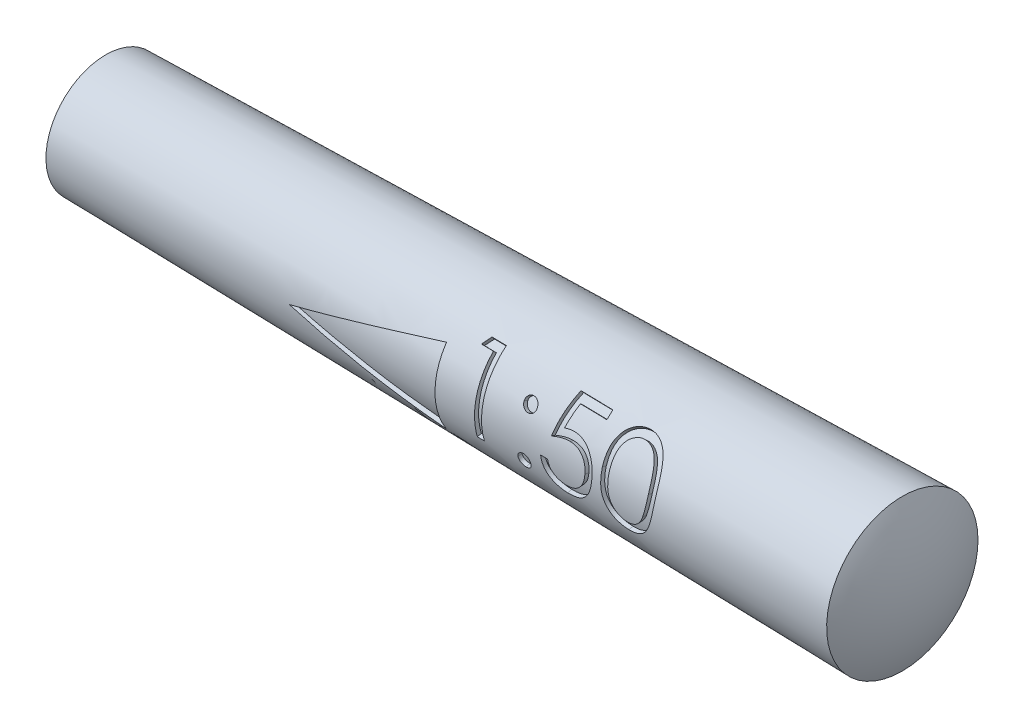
SolidWorks part; units mm, degrees
ref_plane "Front Plane" through (0, 0, 0) normal (0, 0, 1) x (1, 0, 0)
ref_plane "Top Plane" through (0, 0, 0) normal (0, 1, 0) x (1, 0, 0)
ref_plane "Right Plane" through (0, 0, 0) normal (1, 0, 0) x (0, 0, -1)
sketch "Sketch1" plane through (0, 0, 0) normal (1, 0, 0) x (0, 0, -1)
  circle A0 centre (0, 0) radius 0.75
  dimension "D1" = 1.5
extrude "Extrude1" add sketch "Sketch1" along normal mid plane 10
draft "Draft1" type of draft neutral plane draft angle 1.146 faces to draft 1 parameters "D1"=1.146
sketch "Sketch2" plane through (0, 0, 0) normal (0, 0, 1) x (1, 0, 0)
  line L0 (-5, 0) -> (-5, 0.75)
  line L1 (-5, 0.75) -> (-5, -0.75) construction
  line L2 (-5, 0) -> (-5.23, 0)
  line L3 (-5.23, 0) -> (-5.23, -0.85) construction
  line L4 (5, 0) -> (5, 0.95)
  line L5 (5, -0.95) -> (5, 0.95) construction
  line L6 (5, 0) -> (5.23, 0)
  line L7 (5.23, 0) -> (5.23, -0.85) construction
  line L8 (-5, -0.75) -> (5, -0.95) construction
  arc A0 (-5.23, 0) -> (-5, 0.75) centre (-3.8922, 0) cw
  arc A1 (5.23, 0) -> (5, 0.95) centre (3.153, 0) ccw
  point P14 (0, -0.85)
revolve "Revolve1" add sketch "Sketch2" angle 360 about L2
sketch "Sketch5" plane through (0, 0, 0) normal (0, 0, 1) x (1, 0, 0)
  line L0 (0, 0.85) -> (0, -0.85) construction
  line L1 (5, 0.95) -> (-5, 0.75) construction
  line L2 (-5, -0.75) -> (5, -0.95) construction
ref_plane "Plane2" through (0, 0, 0) normal (-0.02, 0, 0.9998) x (0.9998, 0, 0.02)
sketch "Sketch6" plane through (0, 0, 0) normal (-0.02, 0, 0.9998) x (0.9998, 0, 0.02)
  line L0 (0, 0) -> (0, 0.5)
  line L1 (0, 0.85) -> (0, -0.85) construction
  line L2 (0, 0.5) -> (-1.866, 0)
  line L3 (-1.866, 0) -> (0, -0.5)
  line L4 (0, -0.5) -> (0, 0)
  line L5 (0, -0.25) -> (3, -0.25) construction
  text T0 "1:50" font "Century Gothic" height 1
  dimension "D1" = 1
  dimension "D2" = 30
  dimension "D3" = 3
wrap "Wrap2" sketch "Sketch6" wrap type deboss source sketch "Sketch6" thickness 0.05 parameters "D1"=0.05
equation "\"D2@Sketch2\" = \"D1@Sketch2\""
